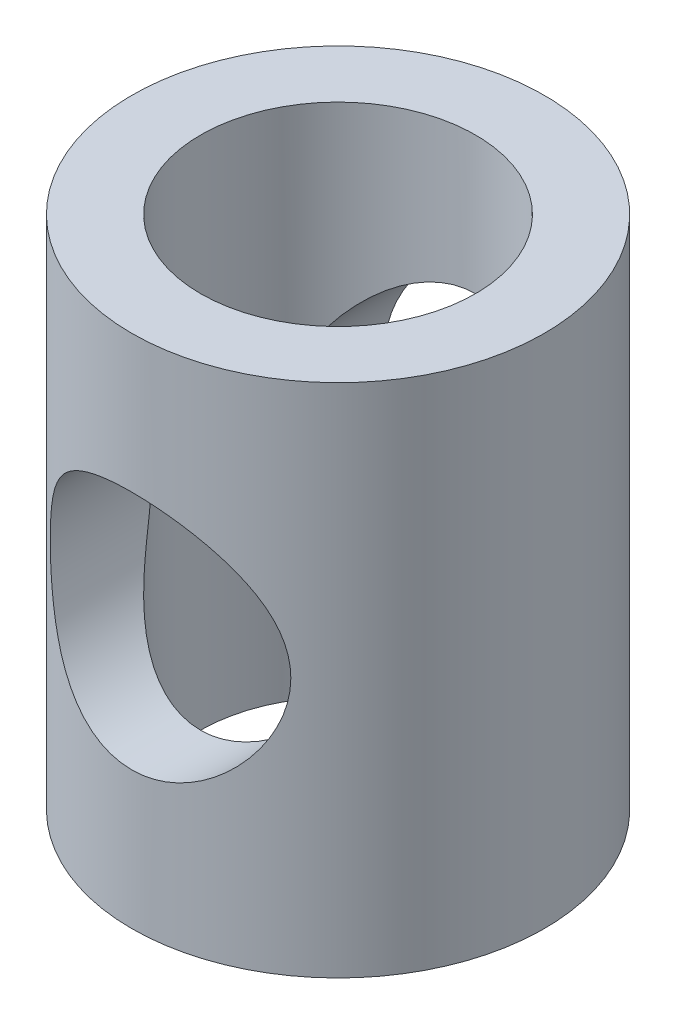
SolidWorks part; units mm, degrees
ref_plane "前视基准面" through (0, 0, 0) normal (0, 0, 1) x (1, 0, 0)
ref_plane "上视基准面" through (0, 0, 0) normal (0, 1, 0) x (1, 0, 0)
ref_plane "右视基准面" through (0, 0, 0) normal (1, 0, 0) x (0, 0, -1)
sketch "草图1" plane through (0, 0, 0) normal (0, 1, 0) x (1, 0, 0)
  circle A0 centre (0, 0) radius 30
  circle A1 centre (0, 0) radius 20
  dimension "D1" = 60
  dimension "D2" = 40
extrude "拉伸1" add sketch "草图1" along normal blind 75
sketch "草图2" plane through (0, 0, 0) normal (0, 0, 1) x (1, 0, 0)
  line L0 (0, 0) -> (0, 82.7445) construction
  line L1 (-45.3995, 37.5) -> (45.3995, 37.5) construction
  line L2 (30, 75) -> (-30, 75) construction
  line L3 (-30, 0) -> (30, 0) construction
  circle A0 centre (0, 37.5) radius 17.5
  dimension "D1" = 35
extrude "切除-拉伸1" cut sketch "草图2" against normal mid plane 90
